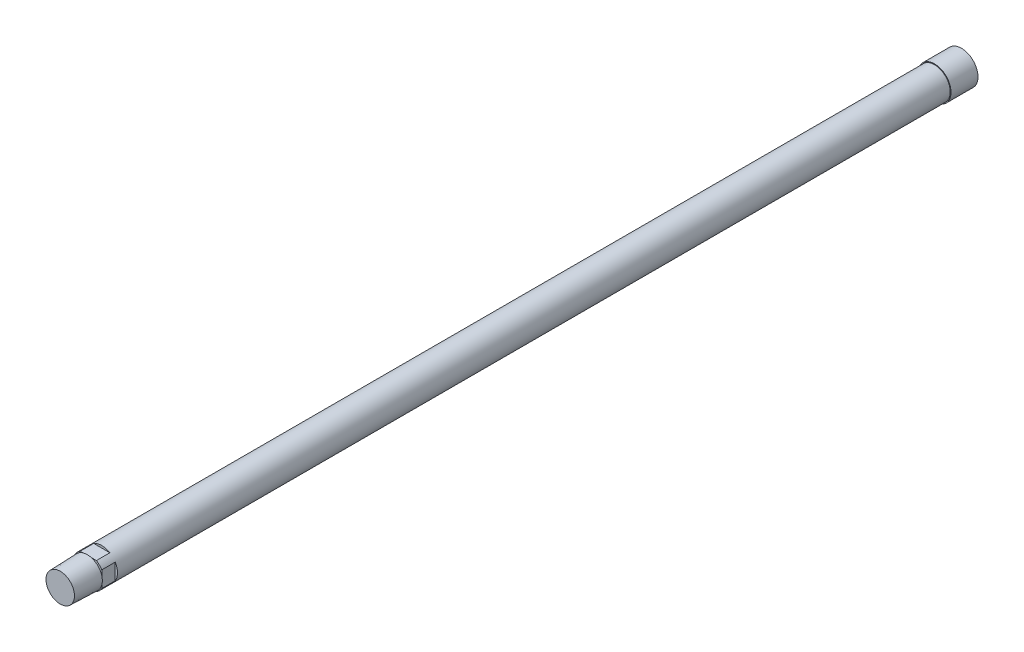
SolidWorks part; units mm, degrees
ref_plane "Front" through (0, 0, 0) normal (0, 0, 1) x (1, 0, 0)
ref_plane "Top" through (0, 0, 0) normal (0, 1, 0) x (1, 0, 0)
ref_plane "Right" through (0, 0, 0) normal (1, 0, 0) x (0, 0, -1)
sketch "Sketch1" plane through (0, 0, 0) normal (0, 0, 1) x (1, 0, 0)
  circle A0 centre (0, 0) radius 11.1125
  circle A1 centre (0, 0) radius 6.35
  dimension "D1" = 22.225
  dimension "D2" = 12.7
extrude "Base-Extrude" add sketch "Sketch1" along normal blind 617.8804
sketch "Sketch8" plane through (0, 0, 0) normal (0, 0, -1) x (-1, 0, 0)
  circle A0 centre (0, 0) radius 7.62
  dimension "D1" = 15.24
extrude "Cut-Extrude4" cut sketch "Sketch8" against normal blind 7.62
sketch "Sketch9" plane through (0, 0, 0) normal (1, 0, 0) x (0, 0, -1)
  line L0 (0, 11.1125) -> (-617.8804, 11.1125) construction
  line L1 (-617.8804, 11.1125) -> (-617.8804, -11.1125) construction
  line L2 (-617.8804, 8.9027) -> (-616.9787, 10.3785)
  line L3 (-616.9787, 10.3785) -> (-616.077, 8.9587)
  line L4 (-617.8804, 8.9027) -> (-617.8804, 11.1125)
  line L5 (-617.8804, 11.1125) -> (-598.043, 11.1125)
  line L6 (-617.8804, 0) -> (-116.2585, 0) construction
  line L7 (-598.043, 11.1125) -> (-598.043, 9.5192)
  line L8 (-617.8804, 9.6266) -> (-145.4923, 24.3069) construction
  line L9 (-617.8804, -11.5409) -> (-617.8804, 8.9027) construction
  line L10 (-617.8804, 8.9027) -> (-598.043, 9.5192) construction
  line L11 (-617.8804, 10.3505) -> (-598.043, 10.967) construction
  line L12 (-616.077, 8.9587) -> (-615.1753, 10.4346)
  line L15 (-615.1753, 10.4346) -> (-614.2736, 9.0148)
  line L16 (-614.2736, 9.0148) -> (-613.3719, 10.4906)
  line L17 (-613.3719, 10.4906) -> (-612.4702, 9.0708)
  line L18 (-612.4702, 9.0708) -> (-611.5685, 10.5467)
  line L19 (-611.5685, 10.5467) -> (-610.6668, 9.1269)
  line L20 (-610.6668, 9.1269) -> (-609.7651, 10.6027)
  line L21 (-609.7651, 10.6027) -> (-608.8634, 9.1829)
  line L22 (-608.8634, 9.1829) -> (-607.9617, 10.6587)
  line L23 (-607.9617, 10.6587) -> (-607.06, 9.239)
  line L24 (-607.06, 9.239) -> (-606.1583, 10.7148)
  line L25 (-606.1583, 10.7148) -> (-605.2566, 9.295)
  line L26 (-605.2566, 9.295) -> (-604.3549, 10.7708)
  line L27 (-604.3549, 10.7708) -> (-603.4532, 9.3511)
  line L28 (-603.4532, 9.3511) -> (-602.5515, 10.8269)
  line L29 (-602.5515, 10.8269) -> (-601.6498, 9.4071)
  line L30 (-601.6498, 9.4071) -> (-600.7481, 10.8829)
  line L31 (-600.7481, 10.8829) -> (-599.8464, 9.4631)
  line L32 (-599.8464, 9.4631) -> (-598.9447, 10.939)
  line L33 (-598.9447, 10.939) -> (-598.043, 9.5192)
  dimension "D1" = 19.8374
  dimension "D2" = 1.78
  dimension "D3" = 19.2532
  dimension "D4" = 17.8054
  dimension "D5" = 180
  dimension "D6" = 20.701
  dimension "D7" = 180
  dimension "D8" = 1.8034
  dimension "D9" = 0.9017
  dimension "D12" = 3.6068
  dimension "D13" = 5.4102
  dimension "D14" = 7.2136
  dimension "D15" = 9.017
  dimension "D16" = 10.8204
  dimension "D17" = 12.6238
  dimension "D18" = 14.4272
  dimension "D19" = 16.2306
  dimension "D20" = 18.034
  dimension "D21" = 18.9357
  dimension "D22" = 17.1323
  dimension "D23" = 15.3289
  dimension "D24" = 13.5255
  dimension "D25" = 11.7221
  dimension "D26" = 9.9187
  dimension "D27" = 8.1153
  dimension "D28" = 6.3119
  dimension "D29" = 4.5085
  dimension "D30" = 2.7051
revolve "Cut-Revolve1" cut sketch "Sketch9" angle 360 about L6
sketch "Sketch10" plane through (0, 0, 0) normal (1, 0, 0) x (0, 0, -1)
  line L0 (-617.8804, 11.1125) -> (-598.043, 11.1125)
  line L1 (-598.043, 11.1125) -> (-598.043, 10.668)
  line L2 (-598.043, 11.1125) -> (-598.043, -11.1125) construction
  line L3 (-617.8804, 0) -> (-90.4202, 0) construction
  line L4 (-617.8804, 8.9027) -> (-617.8804, -8.9027) construction
  line L6 (-598.043, 10.668) -> (-617.8804, 10.0515)
  line L7 (-617.8804, 10.0515) -> (-617.8804, 11.1125)
  line L8 (-617.8804, 0) -> (-119.8446, 0) construction
  line L9 (0, 11.1125) -> (-598.043, 11.1125) construction
  dimension "D1" = 1.78
  dimension "D2" = 10.668
  dimension "D4" = 19.8374
revolve "Cut-Revolve2" cut sketch "Sketch10" angle 360 about L8
sketch "Sketch11" plane through (0, 0, 598.043) normal (0, 0, 1) x (1, 0, 0)
  line L1 (-9.525, -9.525) -> (9.525, -9.525)
  line L2 (-9.525, -9.525) -> (-9.525, 9.525)
  line L3 (-9.525, 9.525) -> (9.525, 9.525)
  line L4 (9.525, -9.525) -> (9.525, 9.525)
  circle A0 centre (0, 0) radius 15.875
  dimension "D5" = 31.75
  dimension "D1" = 19.05
  dimension "D2" = 19.05
  dimension "D3" = 9.525
  dimension "D4" = 9.525
extrude "Cut-Extrude5" cut sketch "Sketch11" against normal blind 9.525
ref_plane "Plane5" through (11.1125, 0, 0) normal (1, 0, 0) x (0, 0, -1)
sketch "Sketch12" plane through (11.1125, 0, 0) normal (1, 0, 0) x (0, 0, -1)
  line L0 (0, -11.1125) -> (0, 11.1125) construction
  circle A0 centre (-15.875, 0) radius 1.6891
  dimension "D1" = 3.3782
  dimension "D2" = 15.875
extrude "Cut-Extrude6" [suppressed] cut sketch "Sketch12" against normal blind 3.556
pattern_circular "CirPattern2" [suppressed] count 4 over 360
sketch "Sketch13" plane through (0, 0, 0) normal (1, 0, 0) x (0, 0, -1)
  line L0 (-617.8804, 10.0515) -> (-598.7585, 10.6458)
  line L1 (-616.7925, 10.0853) -> (-617.1649, 10.0738) construction
  line L2 (-617.8804, 8.9027) -> (-617.8804, -8.9027) construction
  line L3 (-617.8804, 10.0515) -> (-617.8804, 0)
  line L4 (-118.7285, 0) -> (3.1058, 0) construction
  line L5 (-617.8804, 0) -> (0, 0)
  line L6 (0, 0) -> (0, 11.1125)
  line L7 (0, 11.1125) -> (-7.62, 11.1125)
  line L9 (-7.62, 11.1125) -> (-7.62, 6.35)
  line L10 (-7.62, 6.35) -> (-617.8804, 6.35) construction
  line L11 (-7.62, -7.62) -> (-7.62, 7.62) construction
  line L12 (-7.62, 6.35) -> (-598.043, 6.35)
  line L13 (-598.043, 9.525) -> (-598.043, 5.7238) construction
  line L14 (-598.043, 6.35) -> (-598.043, 9.5192)
  line L15 (-598.043, 9.5192) -> (-598.7585, 10.6458) construction
  line L16 (-598.043, 9.5192) -> (-598.7585, 10.6458)
  line L17 (0, 11.1125) -> (-588.518, 11.1125) construction
revolve "WEB Revolve1" add sketch "Sketch13" angle 360 about L4
sketch "Sketch14" plane through (0, 0, 0) normal (0, 0, -1) x (-1, 0, 0)
  circle A0 centre (0, 0) radius 11.684
  dimension "D1" = 23.368
extrude "WEB Extrude1" add sketch "Sketch14" along normal blind 19.05
